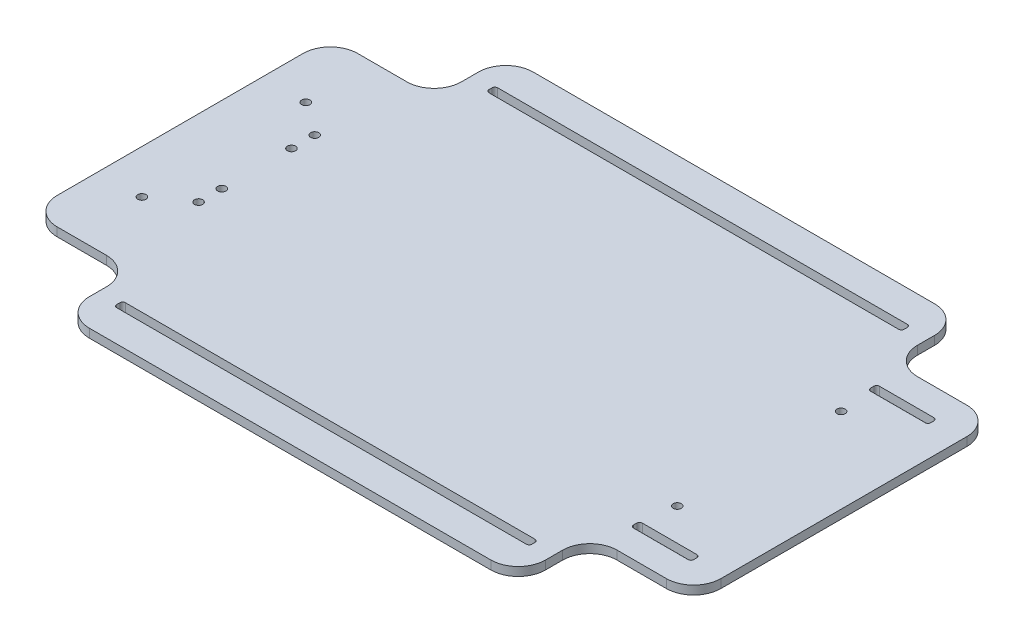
SolidWorks part; units mm, degrees
ref_plane "Front Plane" through (0, 0, 0) normal (0, 0, 1) x (1, 0, 0)
ref_plane "Top Plane" through (0, 0, 0) normal (0, 1, 0) x (1, 0, 0)
ref_plane "Right Plane" through (0, 0, 0) normal (1, 0, 0) x (0, 0, -1)
sketch "Sketch1" plane through (0, 0, 0) normal (0, 1, 0) x (1, 0, 0)
  line L0 (0, 81.235) -> (243, 81.235) construction
  line L1 (0, 0) -> (243, 0)
  line L2 (0, 0) -> (0, 162.47)
  line L3 (0, 162.47) -> (243, 162.47)
  line L4 (243, 0) -> (243, 162.47)
  line L5 (0, 0) -> (38, 0)
  line L6 (0, 0) -> (0, 26.235)
  line L7 (0, 26.235) -> (38, 26.235)
  line L8 (38, 0) -> (38, 26.235)
  line L9 (243, 0) -> (205, 0)
  line L10 (243, 0) -> (243, 26.235)
  line L11 (243, 26.235) -> (205, 26.235)
  line L12 (205, 0) -> (205, 26.235)
  line L13 (0, 162.47) -> (38, 162.47)
  line L14 (0, 162.47) -> (0, 136.235)
  line L15 (0, 136.235) -> (38, 136.235)
  line L16 (38, 162.47) -> (38, 136.235)
  line L17 (243, 162.47) -> (205, 162.47)
  line L18 (243, 162.47) -> (243, 136.235)
  line L19 (243, 136.235) -> (205, 136.235)
  line L20 (205, 162.47) -> (205, 136.235)
  line L21 (45.5, 14.675) -> (197.5, 14.675)
  line L22 (45.5, 14.675) -> (45.5, 11.5)
  line L23 (45.5, 11.5) -> (197.5, 11.5)
  line L24 (197.5, 14.675) -> (197.5, 11.5)
  line L26 (210, 39.435) -> (232, 39.435)
  line L27 (210, 39.435) -> (210, 36.235)
  line L28 (210, 36.235) -> (232, 36.235)
  line L29 (232, 39.435) -> (232, 36.235)
  line L30 (210, 126.235) -> (232, 126.235)
  line L31 (210, 126.235) -> (210, 123.035)
  line L32 (210, 123.035) -> (232, 123.035)
  line L33 (232, 126.235) -> (232, 123.035)
  dimension "D1" = 243
  dimension "D2" = 162.47
  dimension "D3" = 110
  dimension "D4" = 38
  dimension "D5" = 3.175
  dimension "D6" = 11.5
  dimension "D7" = 152
  dimension "D8" = 45.5
  dimension "D9" = 3.2
  dimension "D10" = 22
  dimension "D11" = 10
  dimension "D12" = 10
  dimension "D13" = 22
  dimension "D14" = 11
  dimension "D15" = 11
extrude "Boss-Extrude1" add sketch "Sketch1" along normal blind 3.175 contours L2 L0 L4 L19 L20 L3 L16 L15 | L0 L2 L7 L8 L1 L12 L11 L4 L21 L24 L23 L22
ref_plane "Plane1" through (0, 0, -81.235) normal (0, 0, 1) x (1, 0, 0)
mirror "Mirror3" about plane through (0, 0, -81.235) normal (0, 0, 1) of "Boss-Extrude1"
fillet "Fillet1" radius 10 12 edges at (38, 1.5875, -162.47) (38, 1.5875, -136.235) (0, 1.5875, -136.235) (205, 1.5875, -162.47) (205, 1.5875, -136.235) (243, 1.5875, -136.235) (243, 1.5875, -26.235) (205, 1.5875, -26.235) (205, 1.5875, 0) (38, 1.5875, 0) (38, 1.5875, -26.235) (0, 1.5875, -26.235)
fillet "Fillet2" radius 1 16 edges at (197.5, 1.5875, -147.795) (197.5, 1.5875, -150.97) (45.5, 1.5875, -150.97) (45.5, 1.5875, -147.795) (197.5, 1.5875, -14.675) (197.5, 1.5875, -11.5) (45.5, 1.5875, -11.5) (45.5, 1.5875, -14.675) (210, 1.5875, -36.235) (232, 1.5875, -36.235) (232, 1.5875, -39.435) (210, 1.5875, -39.435) (210, 1.5875, -126.235) (232, 1.5875, -126.235) (232, 1.5875, -123.035) (210, 1.5875, -123.035)
sketch "Sketch2" plane through (0, 3.175, 0) normal (0, 1, 0) x (1, 0, 0)
  line L0 (0, 36.235) -> (0, 126.235) construction
  line L1 (-1.7463, 81.235) -> (1.7462, 81.235) construction
  circle A0 centre (16, 111.235) radius 1.5
  circle A1 centre (16, 51.235) radius 1.5
  circle A2 centre (212, 111.235) radius 1.5
  circle A3 centre (212, 51.235) radius 1.5
  dimension "D1" = 3
  dimension "D2" = 60
  dimension "D3" = 196
  dimension "D4" = 16
  dimension "D5" = 30
extrude "Cut-Extrude1" cut sketch "Sketch2" against normal through all
sketch "Sketch3" plane through (0, 3.175, 0) normal (0, 1, 0) x (1, 0, 0)
  line L0 (28, 136.235) -> (28, 26.235) construction
  line L1 (0, 81.235) -> (243, 81.235) construction
  line L2 (0, 36.235) -> (0, 126.235) construction
  line L3 (243, 36.235) -> (243, 126.235) construction
  circle A0 centre (28, 93.985) radius 1.5
  circle A1 centre (28, 102.485) radius 1.5
  circle A2 centre (28, 59.985) radius 1.5
  circle A3 centre (28, 68.485) radius 1.5
  dimension "D1" = 3
  dimension "D2" = 8.5
  dimension "D3" = 12.75
extrude "Cut-Extrude2" cut sketch "Sketch3" against normal through all
